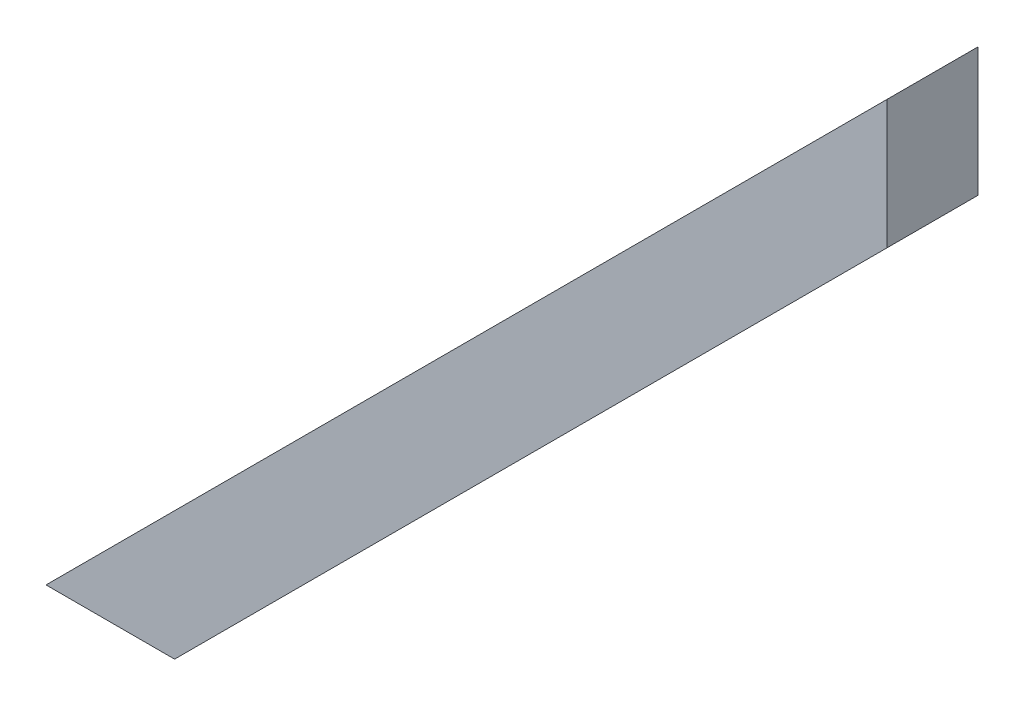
SolidWorks part; units mm, degrees
ref_plane "Plan de face" through (0, 0, 0) normal (0, 0, 1) x (1, 0, 0)
ref_plane "Plan de dessus" through (0, 0, 0) normal (0, 1, 0) x (1, 0, 0)
ref_plane "Plan de droite" through (0, 0, 0) normal (1, 0, 0) x (0, 0, -1)
sketch "Esquisse1" plane through (0, 0, 0) normal (0, 0, 1) x (1, 0, 0)
  line L0 (410, 353.4315) -> (96.5685, 40)
  line L1 (96.5685, 40) -> (40, 40)
  line L2 (40, 40) -> (410, 410)
  line L3 (410, 410) -> (410, 353.4315)
extrude "Boss.-Extru.1" add sketch "Esquisse1" against normal blind 40
